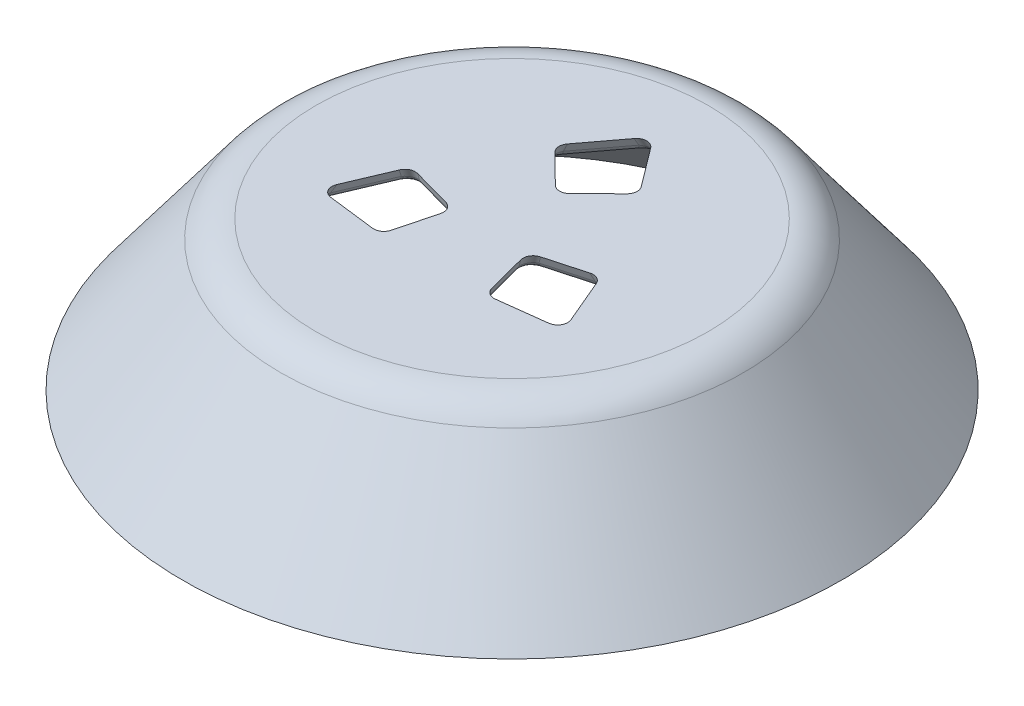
SolidWorks part; units mm, degrees
ref_plane "Front Plane" through (0, 0, 0) normal (0, 0, 1) x (1, 0, 0)
ref_plane "Top Plane" through (0, 0, 0) normal (0, 1, 0) x (1, 0, 0)
ref_plane "Right Plane" through (0, 0, 0) normal (1, 0, 0) x (0, 0, -1)
sketch "Sketch1" plane through (0, 0, 0) normal (1, 0, 0) x (0, 0, -1)
  line L0 (0, 0) -> (0, 11.8952) construction
  line L1 (0, 4) -> (7.5, 4)
  line L2 (7.5, 4) -> (10.5, 0)
  line L3 (10.5, 0) -> (13, 0)
  line L4 (13, 0) -> (8.5, 6)
  line L5 (8.5, 6) -> (0, 6)
  line L8 (0, 6) -> (0, 4)
  dimension "D1" = 13
  dimension "D2" = 6
  dimension "D4" = 2
  dimension "D5" = 2
  dimension "D6" = 8.5
revolve "Revolve1" add sketch "Sketch1" angle 360 about L0
sketch "Sketch2" plane through (0, 6, 0) normal (0, 1, 0) x (1, 0, 0)
  line L0 (0, 6.8) -> (-2.25, 3.8162)
  line L1 (-2.25, 3.8162) -> (0, 1.6)
  line L2 (0, 1.6) -> (2.25, 3.8162)
  line L3 (2.25, 3.8162) -> (0, 6.8)
  line L4 (0, 0) -> (0, 6.8) construction
  dimension "D1" = 4.5
  dimension "D2" = 5.2
  dimension "D3" = 6.8
  dimension "D4" = 2.2162
  dimension "D5" = 3.7371
extrude "Boss-Extrude1" add sketch "Sketch2" along normal blind 1 draft 20
pattern_circular "CirPattern1" count 3 over 360 about axis through (0, 0, 0) along (0, 1, 0) of "Boss-Extrude1"
fillet "Fillet1" radius 2 1 edges at (0, 6, -8.5)
fillet "Fillet2" radius 0.5 24 edges at (-2.3159, 6.5, 3.6565) (-1.6069, 6.5, 0.9277) (-4.3246, 6.5, 0.1774) (-5.6272, 6.5, 3.2489) (4.3246, 6.5, 0.1774) (1.6069, 6.5, 0.9277) (2.3159, 6.5, 3.6565) (5.6272, 6.5, 3.2489) (-2.0087, 6.5, -3.8339) (0, 6.5, -1.8554) (0, 6.5, -6.4977) (2.0087, 6.5, -3.8339) (-1.7828, 6, 2.3283) (-2.9078, 6, 0.3798) (-5.1594, 6, 1.6798) (-4.0344, 6, 3.6283) (2.9078, 6, 0.3798) (1.7828, 6, 2.3283) (4.0344, 6, 3.6283) (-1.125, 6, -2.7081) (1.125, 6, -2.7081) (1.125, 6, -5.3081) (-1.125, 6, -5.3081) (5.1594, 6, 1.6798)
sketch "Sketch3" plane through (0, 0, 0) normal (1, 0, 0) x (0, 0, -1)
  line L1 (7.5, 6) -> (-7.5, 6) construction
  line L3 (0, 0) -> (0, 6.7) construction
  line L9 (7.5, 6) -> (0, 6)
  line L12 (13, 0) -> (9.1, 5.2) construction
  line L14 (0, 6.7) -> (0, 6)
  line L15 (13, 0) -> (9.1, 5.2)
  line L16 (14.875, 0) -> (10.45, 5.9)
  line L17 (8.85, 6.7) -> (0, 6.7)
  line L18 (13, 0) -> (14.875, 0)
  line L19 (14.2, 0.9) -> (9.85, 6.7) construction
  line L20 (9.85, 6.7) -> (0, 6.7) construction
  line L21 (9.1, 5.2) -> (0, 5.2) construction
  arc A0 (10.45, 5.9) -> (8.85, 6.7) centre (8.85, 4.7) ccw
  arc A1 (9.1, 5.2) -> (7.5, 6) centre (7.5, 4) ccw construction
  arc A2 (9.1, 5.2) -> (7.5, 6) centre (7.5, 4) ccw
  dimension "D2" = 2
  dimension "D1" = 1.5
revolve "Revolve2" add sketch "Sketch3" angle 360 about L3
combine bodies "Combine1" operation type subtract main body 105 bodies to subtract 103
